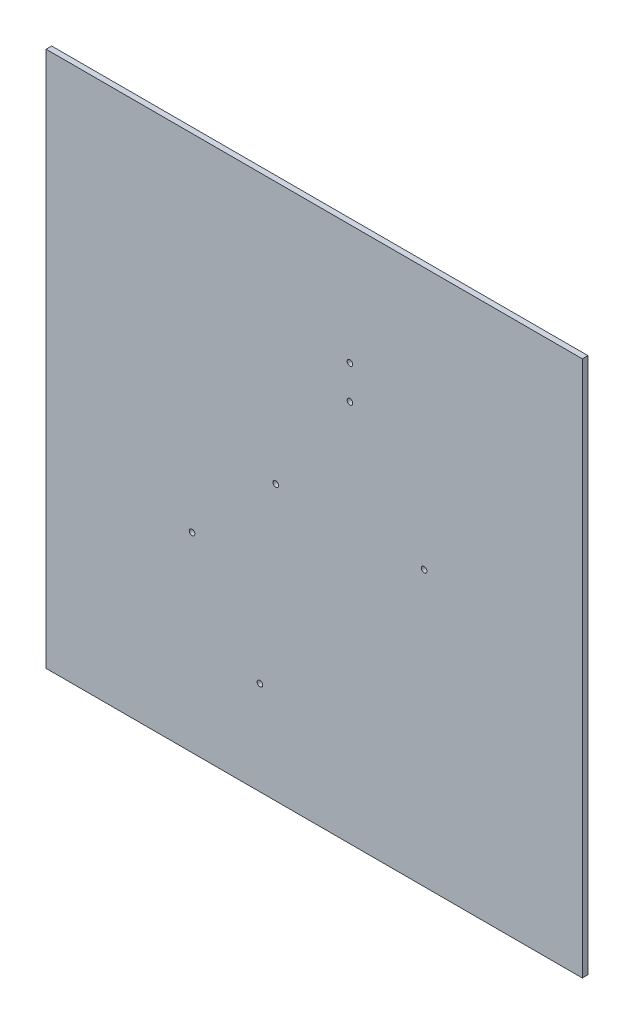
SolidWorks part; units mm, degrees
ref_plane "Front Plane" through (0, 0, 0) normal (0, 0, 1) x (1, 0, 0)
ref_plane "Top Plane" through (0, 0, 0) normal (0, 1, 0) x (1, 0, 0)
ref_plane "Right Plane" through (0, 0, 0) normal (1, 0, 0) x (0, 0, -1)
sketch "Sketch1" plane through (0, 0, 0) normal (0, 0, 1) x (1, 0, 0)
  line L0 (130.5472, 156.0335) -> (214.8752, 156.0335) construction
  line L1 (0, 0) -> (304.8, 0)
  line L2 (0, 0) -> (0, 304.8)
  line L3 (0, 304.8) -> (304.8, 304.8)
  line L4 (304.8, 0) -> (304.8, 304.8)
  line L5 (130.5472, 156.0335) -> (82.9518, 108.4381) construction
  line L6 (82.9518, 108.4381) -> (121.5592, 53.301) construction
  circle A0 centre (130.5472, 156.0335) radius 1.5875
  circle A1 centre (214.8752, 156.0335) radius 1.5875
  circle A2 centre (82.9518, 108.4381) radius 1.5875
  circle A3 centre (121.5592, 53.301) radius 1.5875
  circle A4 centre (172.7112, 217.6421) radius 1.5875
  circle A5 centre (172.7112, 236.6921) radius 1.5875
  point P13 (172.7112, 156.0335)
  dimension "D3" = 3.175
  dimension "D1" = 304.8
  dimension "D2" = 304.8
  dimension "D4" = 84.328
  dimension "D5" = 67.31
  dimension "D6" = 135
  dimension "D7" = 19.05
  dimension "D8" = 100
extrude "Boss-Extrude1" add sketch "Sketch1" along normal blind 3.175
